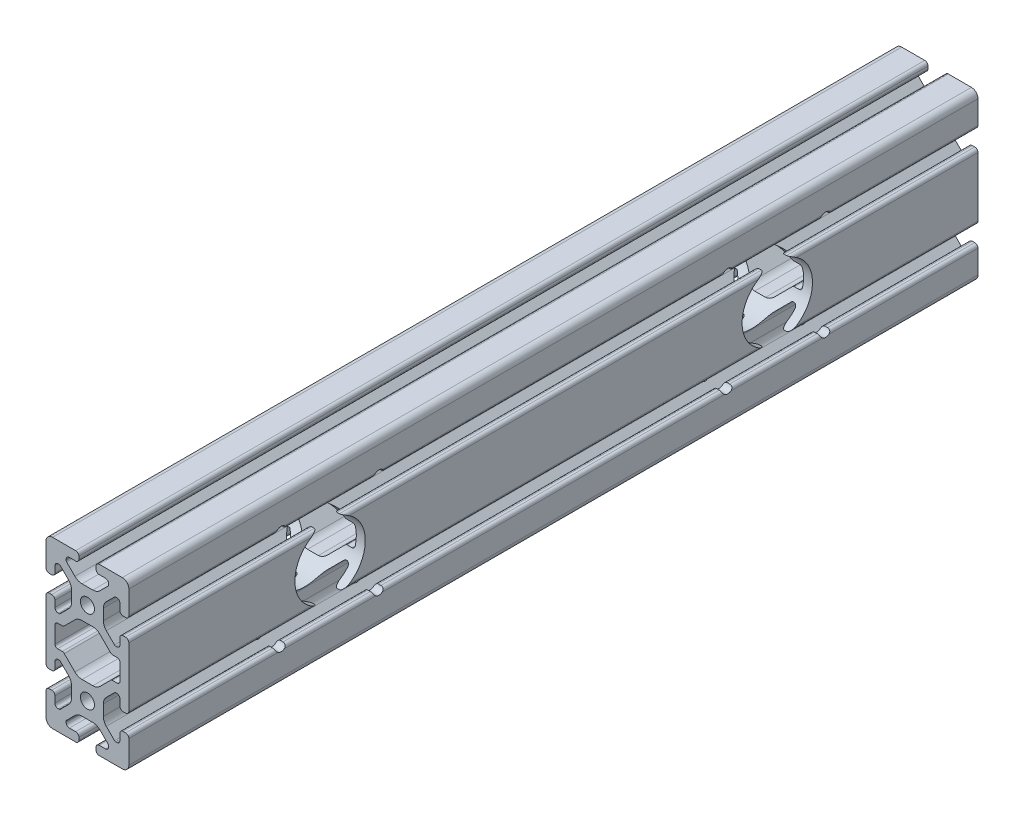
SolidWorks part; units mm, degrees
ref_plane "Front Plane" through (0, 0, 0) normal (0, 0, 1) x (1, 0, 0)
ref_plane "Top Plane" through (0, 0, 0) normal (0, 1, 0) x (1, 0, 0)
ref_plane "Right Plane" through (0, 0, 0) normal (1, 0, 0) x (0, 0, -1)
ref_plane "Plane1" through (0, 0, -3048) normal (0, 0, -1) x (-1, 0, 0)
sketch "Sketch1" plane through (0, 0, -3048) normal (0, 0, -1) x (-1, 0, 0)
  line L0 (14.41, 14.6586) -> (12.13, 14.6586)
  line L1 (11.1794, 14.2308) -> (6.0551, 9.1098)
  line L2 (2.6153, 7.685) -> (-2.6153, 7.685)
  line L3 (-6.0551, 9.1098) -> (-11.232, 14.2867)
  line L4 (-12.13, 14.6586) -> (-14.41, 14.6586)
  line L5 (-15.68, 15.9286) -> (-15.68, 24.0714)
  line L6 (-14.41, 25.3414) -> (-12.13, 25.3414)
  line L7 (-11.232, 25.7133) -> (-6.0551, 30.8902)
  line L8 (-2.6153, 32.315) -> (2.6176, 32.315)
  line L9 (6.0573, 30.8902) -> (11.1842, 25.7634)
  line L10 (12.13, 25.3414) -> (14.41, 25.3414)
  line L11 (15.68, 24.0714) -> (15.68, 15.9286)
  line L12 (16.83, 60) -> (5.6904, 60)
  line L13 (4.1204, 58.43) -> (4.1204, 57.25)
  line L14 (5.6904, 55.68) -> (8.7154, 55.68)
  line L15 (10.2854, 54.11) -> (10.2854, 53.6549)
  line L16 (10.0628, 53.1175) -> (6.0551, 49.1098)
  line L17 (2.6153, 47.685) -> (-2.6153, 47.685)
  line L18 (-6.0551, 49.1098) -> (-10.0628, 53.1175)
  line L19 (-10.2854, 53.6549) -> (-10.2854, 54.11)
  line L20 (-8.7154, 55.68) -> (-5.6904, 55.68)
  line L21 (-4.1204, 57.25) -> (-4.1204, 58.43)
  line L22 (-5.6904, 60) -> (-16.83, 60)
  line L23 (-20, 56.83) -> (-20, 45.6904)
  line L24 (-18.43, 44.1204) -> (-17.25, 44.1204)
  line L25 (-15.68, 45.6904) -> (-15.68, 48.7154)
  line L26 (-14.11, 50.2854) -> (-13.6527, 50.2854)
  line L27 (-13.1153, 50.0628) -> (-9.1098, 46.0573)
  line L28 (-7.685, 42.6176) -> (-7.685, 37.3847)
  line L29 (-9.1098, 33.9449) -> (-13.1175, 29.9372)
  line L30 (-13.6549, 29.7146) -> (-14.11, 29.7146)
  line L31 (-15.68, 31.2846) -> (-15.68, 34.3096)
  line L32 (-17.25, 35.8796) -> (-18.43, 35.8796)
  line L33 (-20, 34.3096) -> (-20, 5.6904)
  line L34 (-18.43, 4.1204) -> (-17.25, 4.1204)
  line L35 (-15.68, 5.6904) -> (-15.68, 8.7154)
  line L36 (-14.11, 10.2854) -> (-13.6549, 10.2854)
  line L37 (-13.1175, 10.0628) -> (-9.1098, 6.0551)
  line L38 (-7.685, 2.6153) -> (-7.685, -2.6153)
  line L39 (-9.1098, -6.0551) -> (-13.1175, -10.0628)
  line L40 (-13.6549, -10.2854) -> (-14.11, -10.2854)
  line L41 (-15.68, -8.7154) -> (-15.68, -5.6904)
  line L42 (-17.25, -4.1204) -> (-18.43, -4.1204)
  line L43 (-20, -5.6904) -> (-20, -16.83)
  line L44 (-16.83, -20) -> (-5.6904, -20)
  line L45 (-4.1204, -18.43) -> (-4.1204, -17.25)
  line L46 (-5.6904, -15.68) -> (-8.7154, -15.68)
  line L47 (-10.2854, -14.11) -> (-10.2854, -13.6549)
  line L48 (-10.0628, -13.1175) -> (-6.0551, -9.1098)
  line L49 (-2.6153, -7.685) -> (2.6153, -7.685)
  line L50 (6.0551, -9.1098) -> (10.0628, -13.1175)
  line L51 (10.2854, -13.6549) -> (10.2854, -14.11)
  line L52 (8.7154, -15.68) -> (5.6904, -15.68)
  line L53 (4.1204, -17.25) -> (4.1204, -18.43)
  line L54 (5.6904, -20) -> (16.83, -20)
  line L55 (20, -16.83) -> (20, -5.6904)
  line L56 (18.43, -4.1204) -> (17.25, -4.1204)
  line L57 (15.68, -5.6904) -> (15.68, -8.7154)
  line L58 (14.11, -10.2854) -> (13.6549, -10.2854)
  line L59 (13.1175, -10.0628) -> (9.1098, -6.0551)
  line L60 (7.685, -2.6153) -> (7.685, 2.6153)
  line L61 (9.1098, 6.0551) -> (13.1175, 10.0628)
  line L62 (13.6549, 10.2854) -> (14.11, 10.2854)
  line L63 (15.68, 8.7154) -> (15.68, 5.6904)
  line L64 (17.25, 4.1204) -> (18.43, 4.1204)
  line L65 (20, 5.6904) -> (20, 34.3096)
  line L66 (18.43, 35.8796) -> (17.25, 35.8796)
  line L67 (15.68, 34.3096) -> (15.68, 31.2846)
  line L68 (14.11, 29.7146) -> (13.6549, 29.7146)
  line L69 (13.1175, 29.9372) -> (9.1098, 33.9449)
  line L70 (7.685, 37.3847) -> (7.685, 42.6153)
  line L71 (9.1098, 46.0551) -> (13.1175, 50.0628)
  line L72 (13.6549, 50.2854) -> (14.11, 50.2854)
  line L73 (15.68, 48.7154) -> (15.68, 45.6904)
  line L74 (17.25, 44.1204) -> (18.43, 44.1204)
  line L75 (20, 45.6904) -> (20, 56.83)
  arc A0 (15.68, 15.9286) -> (14.41, 14.6586) centre (14.41, 15.9286) cw
  arc A1 (12.13, 14.6586) -> (11.1794, 14.2308) centre (12.13, 13.3886) ccw
  arc A2 (6.0551, 9.1098) -> (2.6153, 7.685) centre (2.6153, 12.5496) cw
  arc A3 (-2.6153, 7.685) -> (-6.0551, 9.1098) centre (-2.6153, 12.5496) cw
  arc A4 (-11.232, 14.2867) -> (-12.13, 14.6586) centre (-12.13, 13.3886) ccw
  arc A5 (-14.41, 14.6586) -> (-15.68, 15.9286) centre (-14.41, 15.9286) cw
  arc A6 (-15.68, 24.0714) -> (-14.41, 25.3414) centre (-14.41, 24.0714) cw
  arc A7 (-12.13, 25.3414) -> (-11.232, 25.7133) centre (-12.13, 26.6114) ccw
  arc A8 (-6.0551, 30.8902) -> (-2.6153, 32.315) centre (-2.6153, 27.4504) cw
  arc A9 (2.6176, 32.315) -> (6.0573, 30.8902) centre (2.6176, 27.4504) cw
  arc A10 (11.1842, 25.7634) -> (12.13, 25.3414) centre (12.13, 26.6123) ccw
  arc A11 (14.41, 25.3414) -> (15.68, 24.0714) centre (14.41, 24.0714) cw
  circle A12 centre (0, 0) radius 3.405
  circle A13 centre (0, 40) radius 3.405
  arc A14 (5.6904, 60) -> (4.1204, 58.43) centre (5.6904, 58.43) ccw
  arc A15 (4.1204, 57.25) -> (5.6904, 55.68) centre (5.6904, 57.25) ccw
  arc A16 (8.7154, 55.68) -> (10.2854, 54.11) centre (8.7154, 54.11) cw
  arc A17 (10.2854, 53.6549) -> (10.0628, 53.1175) centre (9.5254, 53.6549) cw
  arc A18 (6.0551, 49.1098) -> (2.6153, 47.685) centre (2.6153, 52.5496) cw
  arc A19 (-2.6153, 47.685) -> (-6.0551, 49.1098) centre (-2.6153, 52.5496) cw
  arc A20 (-10.0628, 53.1175) -> (-10.2854, 53.6549) centre (-9.5254, 53.6549) cw
  arc A21 (-10.2854, 54.11) -> (-8.7154, 55.68) centre (-8.7154, 54.11) cw
  arc A22 (-5.6904, 55.68) -> (-4.1204, 57.25) centre (-5.6904, 57.25) ccw
  arc A23 (-4.1204, 58.43) -> (-5.6904, 60) centre (-5.6904, 58.43) ccw
  arc A24 (-16.83, 60) -> (-20, 56.83) centre (-16.83, 56.83) ccw
  arc A25 (-20, 45.6904) -> (-18.43, 44.1204) centre (-18.43, 45.6904) ccw
  arc A26 (-17.25, 44.1204) -> (-15.68, 45.6904) centre (-17.25, 45.6904) ccw
  arc A27 (-15.68, 48.7154) -> (-14.11, 50.2854) centre (-14.11, 48.7154) cw
  arc A28 (-13.6527, 50.2854) -> (-13.1153, 50.0628) centre (-13.6527, 49.5254) cw
  arc A29 (-9.1098, 46.0573) -> (-7.685, 42.6176) centre (-12.5496, 42.6176) cw
  arc A30 (-7.685, 37.3847) -> (-9.1098, 33.9449) centre (-12.5496, 37.3847) cw
  arc A31 (-13.1175, 29.9372) -> (-13.6549, 29.7146) centre (-13.6549, 30.4746) cw
  arc A32 (-14.11, 29.7146) -> (-15.68, 31.2846) centre (-14.11, 31.2846) cw
  arc A33 (-15.68, 34.3096) -> (-17.25, 35.8796) centre (-17.25, 34.3096) ccw
  arc A34 (-18.43, 35.8796) -> (-20, 34.3096) centre (-18.43, 34.3096) ccw
  arc A35 (-20, 5.6904) -> (-18.43, 4.1204) centre (-18.43, 5.6904) ccw
  arc A36 (-17.25, 4.1204) -> (-15.68, 5.6904) centre (-17.25, 5.6904) ccw
  arc A37 (-15.68, 8.7154) -> (-14.11, 10.2854) centre (-14.11, 8.7154) cw
  arc A38 (-13.6549, 10.2854) -> (-13.1175, 10.0628) centre (-13.6549, 9.5254) cw
  arc A39 (-9.1098, 6.0551) -> (-7.685, 2.6153) centre (-12.5496, 2.6153) cw
  arc A40 (-7.685, -2.6153) -> (-9.1098, -6.0551) centre (-12.5496, -2.6153) cw
  arc A41 (-13.1175, -10.0628) -> (-13.6549, -10.2854) centre (-13.6549, -9.5254) cw
  arc A42 (-14.11, -10.2854) -> (-15.68, -8.7154) centre (-14.11, -8.7154) cw
  arc A43 (-15.68, -5.6904) -> (-17.25, -4.1204) centre (-17.25, -5.6904) ccw
  arc A44 (-18.43, -4.1204) -> (-20, -5.6904) centre (-18.43, -5.6904) ccw
  arc A45 (-20, -16.83) -> (-16.83, -20) centre (-16.83, -16.83) ccw
  arc A46 (-5.6904, -20) -> (-4.1204, -18.43) centre (-5.6904, -18.43) ccw
  arc A47 (-4.1204, -17.25) -> (-5.6904, -15.68) centre (-5.6904, -17.25) ccw
  arc A48 (-8.7154, -15.68) -> (-10.2854, -14.11) centre (-8.7154, -14.11) cw
  arc A49 (-10.2854, -13.6549) -> (-10.0628, -13.1175) centre (-9.5254, -13.6549) cw
  arc A50 (-6.0551, -9.1098) -> (-2.6153, -7.685) centre (-2.6153, -12.5496) cw
  arc A51 (2.6153, -7.685) -> (6.0551, -9.1098) centre (2.6153, -12.5496) cw
  arc A52 (10.0628, -13.1175) -> (10.2854, -13.6549) centre (9.5254, -13.6549) cw
  arc A53 (10.2854, -14.11) -> (8.7154, -15.68) centre (8.7154, -14.11) cw
  arc A54 (5.6904, -15.68) -> (4.1204, -17.25) centre (5.6904, -17.25) ccw
  arc A55 (4.1204, -18.43) -> (5.6904, -20) centre (5.6904, -18.43) ccw
  arc A56 (16.83, -20) -> (20, -16.83) centre (16.83, -16.83) ccw
  arc A57 (20, -5.6904) -> (18.43, -4.1204) centre (18.43, -5.6904) ccw
  arc A58 (17.25, -4.1204) -> (15.68, -5.6904) centre (17.25, -5.6904) ccw
  arc A59 (15.68, -8.7154) -> (14.11, -10.2854) centre (14.11, -8.7154) cw
  arc A60 (13.6549, -10.2854) -> (13.1175, -10.0628) centre (13.6549, -9.5254) cw
  arc A61 (9.1098, -6.0551) -> (7.685, -2.6153) centre (12.5496, -2.6153) cw
  arc A62 (7.685, 2.6153) -> (9.1098, 6.0551) centre (12.5496, 2.6153) cw
  arc A63 (13.1175, 10.0628) -> (13.6549, 10.2854) centre (13.6549, 9.5254) cw
  arc A64 (14.11, 10.2854) -> (15.68, 8.7154) centre (14.11, 8.7154) cw
  arc A65 (15.68, 5.6904) -> (17.25, 4.1204) centre (17.25, 5.6904) ccw
  arc A66 (18.43, 4.1204) -> (20, 5.6904) centre (18.43, 5.6904) ccw
  arc A67 (20, 34.3096) -> (18.43, 35.8796) centre (18.43, 34.3096) ccw
  arc A68 (17.25, 35.8796) -> (15.68, 34.3096) centre (17.25, 34.3096) ccw
  arc A69 (15.68, 31.2846) -> (14.11, 29.7146) centre (14.11, 31.2846) cw
  arc A70 (13.6549, 29.7146) -> (13.1175, 29.9372) centre (13.6549, 30.4746) cw
  arc A71 (9.1098, 33.9449) -> (7.685, 37.3847) centre (12.5496, 37.3847) cw
  arc A72 (7.685, 42.6153) -> (9.1098, 46.0551) centre (12.5496, 42.6153) cw
  arc A73 (13.1175, 50.0628) -> (13.6549, 50.2854) centre (13.6549, 49.5254) cw
  arc A74 (14.11, 50.2854) -> (15.68, 48.7154) centre (14.11, 48.7154) cw
  arc A75 (15.68, 45.6904) -> (17.25, 44.1204) centre (17.25, 45.6904) ccw
  arc A76 (18.43, 44.1204) -> (20, 45.6904) centre (18.43, 45.6904) ccw
  arc A77 (20, 56.83) -> (16.83, 60) centre (16.83, 56.83) ccw
extrude "Boss-Extrude1" add sketch "Sketch1" against normal blind 3048
ref_plane "2.5 ft cut1" through (0, 0, -762) normal (0, 0, 1) x (1, 0, 0)
ref_plane "2.5 ft cut2" through (0, 0, -1524) normal (0, 0, 1) x (1, 0, 0)
ref_plane "16.14 in cut3" through (0, 0, -1933.956) normal (0, 0, 1) x (1, 0, 0)
ref_plane "13 in cut4" through (0, 0, -2264.156) normal (0, 0, 1) x (1, 0, 0)
ref_plane "midplane cut5" through (0, 0, -2656.078) normal (0, 0, 1) x (1, 0, 0)
sketch "Sketch26" plane through (0, 0, -762) normal (0, 0, 1) x (1, 0, 0)
  line L0 (-20, -20.8001) -> (20, -20.8001)
  line L1 (-20, -20.8001) -> (-20, 60)
  line L2 (-20, 60) -> (20, 60)
  line L3 (20, -20.8001) -> (20, 60)
sketch "Sketch33" plane through (0, 0, -1524) normal (0, 0, 1) x (1, 0, 0)
  line L5 (-20, 60) -> (20, 60)
  line L6 (-20, 60) -> (-20, -20.8001)
  line L7 (-20, -20.8001) -> (20, -20.8001)
  line L8 (20, 60) -> (20, -20.8001)
sketch "Sketch41" plane through (0, 0, -1933.956) normal (0, 0, 1) x (1, 0, 0)
  line L0 (-20, -20.8001) -> (20, -20.8001)
  line L1 (-20, -20.8001) -> (-20, 60)
  line L2 (-20, 60) -> (20, 60)
  line L3 (20, -20.8001) -> (20, 60)
sketch "Sketch50" plane through (0, 0, -2264.156) normal (0, 0, 1) x (1, 0, 0)
  line L0 (-20, -20.8001) -> (20, -20.8001)
  line L1 (-20, -20.8001) -> (-20, 60)
  line L2 (-20, 60) -> (20, 60)
  line L3 (20, -20.8001) -> (20, 60)
sketch "Sketch51" plane through (0, 0, -2656.078) normal (0, 0, 1) x (1, 0, 0)
  line L1 (-20, 60) -> (20, 60)
  line L2 (-20, 60) -> (-20, -20.8001)
  line L3 (-20, -20.8001) -> (20, -20.8001)
  line L4 (20, 60) -> (20, -20.8001)
extrude "Cut-Extrude1" cut sketch "Sketch26" along normal through all
extrude "Cut-Extrude2" cut sketch "Sketch33" along normal through all
extrude "Cut-Extrude3" cut sketch "Sketch41" against normal through all
sketch "Sketch54" plane through (-20, 0, 0) normal (-1, 0, 0) x (0, 0, 1)
  circle A0 centre (-1621.15, 20) radius 17
  circle A1 centre (-1837.05, 20) radius 17
  point P2 (-1621.15, 20)
  dimension "D1" = 34
  dimension "D2" = 215.9
extrude "Cut-Extrude4" cut sketch "Sketch54" against normal through all
sketch "Sketch55" plane through (-20, 0, 0) normal (-1, 0, 0) x (0, 0, 1)
  circle A0 centre (-1644.72, -3.57) radius 2.6
  circle A1 centre (-1597.476, -3.57) radius 2.6
  circle A2 centre (-1597.476, 43.67) radius 2.6
  circle A3 centre (-1644.72, 43.67) radius 2.6
  circle A4 centre (-1813.132, -3.57) radius 2.6
  circle A5 centre (-1860.376, -3.57) radius 2.6
  circle A6 centre (-1813.132, 43.67) radius 2.6
  circle A7 centre (-1860.376, 43.67) radius 2.6
extrude "Cut-Extrude5" cut sketch "Sketch55" against normal through all
